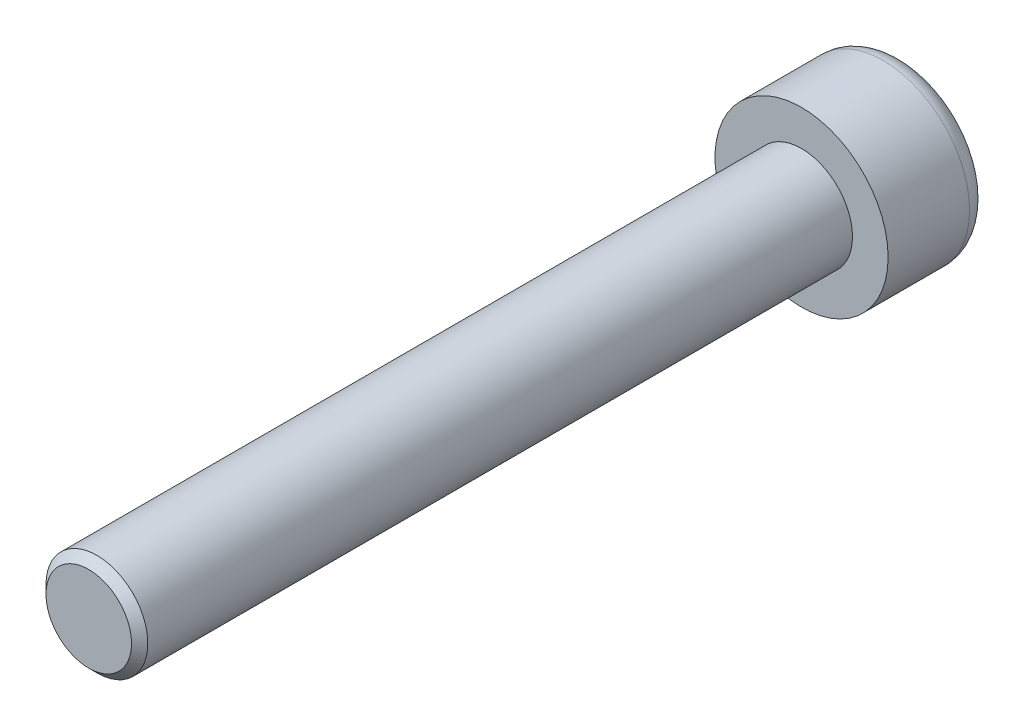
SolidWorks part; units mm, degrees
ref_plane "Plan1" through (0, 0, 0) normal (0, 0, 1) x (1, 0, 0)
ref_plane "Plan2" through (0, 0, 0) normal (0, 1, 0) x (1, 0, 0)
ref_plane "Plan3" through (0, 0, 0) normal (1, 0, 0) x (0, 0, -1)
sketch "profil tête" plane through (0, 0, 0) normal (0, 0, 1) x (1, 0, 0)
  circle A0 centre (0, 0) radius 4.25
  dimension "DIAMETRE" = 8.5
extrude "TETE" add sketch "profil tête" along normal blind 5
sketch "profil six pans" plane through (0, 0, 0) normal (0, 0, -1) x (-1, 0, 0)
  line L0 (0, 2.3094) -> (0, -2.3094) construction
  line L1 (0, 2.3094) -> (-2, 1.1547)
  line L2 (0, 2.3094) -> (2, 1.1547)
  line L3 (-2, 1.1547) -> (-2, -1.1547)
  line L4 (2, 1.1547) -> (2, -1.1547)
  line L5 (-2, -1.1547) -> (0, -2.3094)
  line L6 (2, -1.1547) -> (0, -2.3094)
  line L7 (-2, 1.1547) -> (2, -1.1547) construction
  line L8 (-2, -1.1547) -> (2, 1.1547) construction
  dimension "D1" = 60
  dimension "LARGEUR" = 4
extrude "SIX PANS" cut sketch "profil six pans" against normal blind 3.125
fillet "CONGE" radius 1 1 edges at (4.25, 0, 0)
sketch "profil cylindre" plane through (0, 0, 5) normal (0, 0, 1) x (1, 0, 0)
  circle A0 centre (0, 0) radius 2.5
  dimension "DIAMETRE" = 5
extrude "CYLINDRE FILETE" add sketch "profil cylindre" along normal blind 35
sketch "profil chanfrein" plane through (0, 0, 0) normal (1, 0, 0) x (0, 0, -1)
  line L0 (-40, 2.1) -> (-39.6, 2.5)
  line L1 (-40, 2.5) -> (-40, -2.5) construction
  line L2 (-40, 2.5) -> (-39.6, 2.5)
  line L3 (-5, 2.5) -> (-40, 2.5) construction
  line L4 (-12.0874, 0) -> (-18.1046, 0) construction
  line L5 (-40, 0) -> (-5, 0) construction
  line L8 (-40, 2.5) -> (-40, 2.1)
  dimension "D1" = 45
  dimension "D2" = 4.2
revolve "CHANFREIN FILET" cut sketch "profil chanfrein" angle 360 about L4
equation "\"D2@profil chanfrein\" = \"DIAMETRE FOND FILET@Représentation de filetage1\""
equation "\"HAUTEUR@TETE\"=\"DIAMETRE@profil cylindre\""
equation "\"PROFONDEUR@SIX PANS\" = \"HAUTEUR@TETE\" * 0.625"
equation "\"RAYON@CONGE\"=\"HAUTEUR@TETE\"/5"
